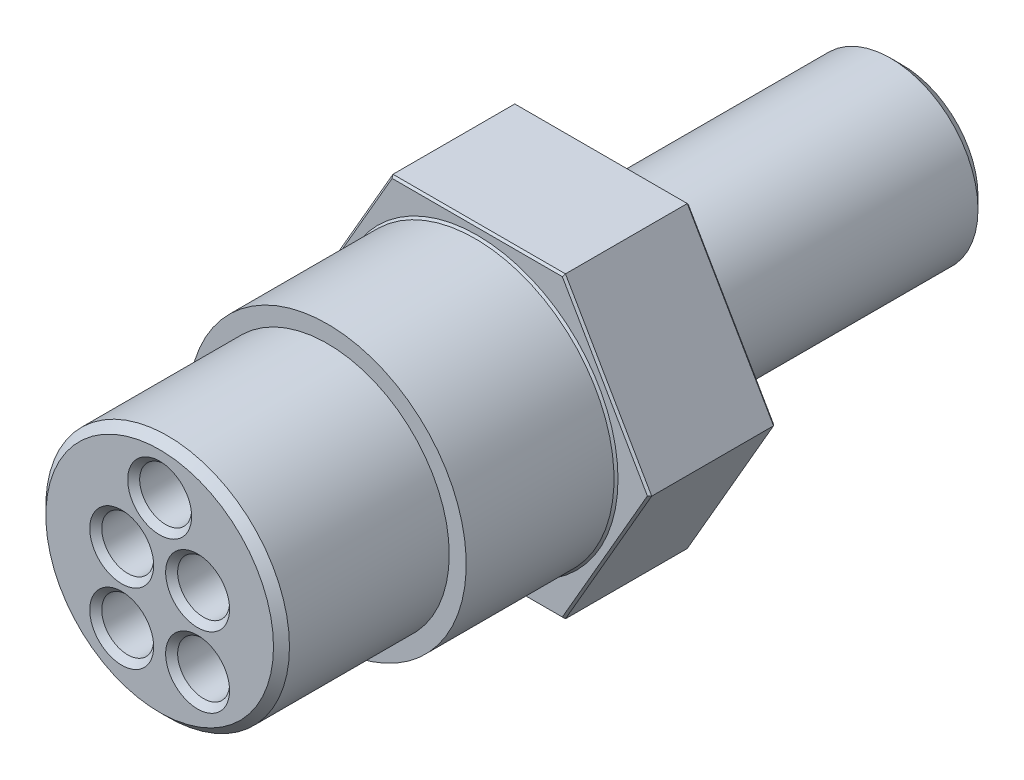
SolidWorks part; units mm, degrees
ref_plane "Front" through (0, 0, 0) normal (0, 0, 1) x (1, 0, 0)
ref_plane "Top" through (0, 0, 0) normal (0, 1, 0) x (1, 0, 0)
ref_plane "Right" through (0, 0, 0) normal (1, 0, 0) x (0, 0, -1)
sketch "Sketch1" plane through (0, 0, 0) normal (0, 0, 1) x (1, 0, 0)
  circle A0 centre (0, 0) radius 5.5562
  dimension "D1" = 11.1125
extrude "post" add sketch "Sketch1" against normal blind 19.05
chamfer "Chamfer1" distance 0.762 angle 45 1 edges at (5.5562, 0, -19.05)
sketch "Sketch2" plane through (0, 0, 0) normal (0, 0, 1) x (1, 0, 0)
  line L1 (-5.4846, 9.4996) -> (-10.9692, 0)
  line L2 (-10.9692, 0) -> (-5.4846, -9.4996)
  line L3 (-5.4846, -9.4996) -> (5.4846, -9.4996)
  line L4 (5.4846, -9.4996) -> (10.9692, 0)
  line L5 (10.9692, 0) -> (5.4846, 9.4996)
  line L6 (5.4846, 9.4996) -> (-5.4846, 9.4996)
  circle A0 centre (0, 0) radius 9.4996 construction
  dimension "D1" = 18.9992
extrude "hex" add sketch "Sketch2" along normal blind 8.001
sketch "Sketch5" plane through (0, 0, 8.001) normal (0, 0, 1) x (1, 0, 0)
  circle A0 centre (0, 0) radius 8.8265
  dimension "D1" = 17.653
extrude "Extrude1" add sketch "Sketch5" along normal blind 9.525
chamfer "Chamfer2" distance 0.127 angle 45 12 edges at (8.2269, 4.7498, 0) (0, 9.4996, 8.001) (-8.2269, 4.7498, 8.001) (-8.2269, -4.7498, 8.001) (0, -9.4996, 8.001) (8.2269, -4.7498, 8.001) (8.2269, 4.7498, 8.001) (-8.8265, 0, 8.001) (0, 9.4996, 0) (-8.2269, -4.7498, 0) (0, -9.4996, 0) (8.2269, -4.7498, 0)
sketch "Sketch3" plane through (0, 0, 17.526) normal (0, 0, 1) x (1, 0, 0)
  circle A0 centre (0, 0) radius 7.747
  dimension "D1" = 15.494
extrude "rubber" add sketch "Sketch3" along normal blind 10.668
chamfer "Chamfer3" distance 0.508 angle 45 1 edges at (7.747, 0, 28.194)
sketch "Sketch4" plane through (0, 0, 28.194) normal (0, 0, 1) x (1, 0, 0)
  line L0 (0, 6.6112) -> (0, -6.1992) construction
  line L3 (0, 0) -> (7.506, 7.506) construction
  line L4 (0, 0) -> (-6.8526, -6.8526) construction
  line L5 (0, 0) -> (7.6052, -7.6052) construction
  line L6 (0, 0) -> (-7.5761, 7.5761) construction
  circle A1 centre (0, 4.572) radius 1.651
  circle A3 centre (2.413, -3.81) radius 1.651
  circle A4 centre (-2.413, 0.6729) radius 1.651
  circle A5 centre (-2.413, -3.81) radius 1.651
  circle A6 centre (2.413, 0.6729) radius 1.651
  dimension "D2" = 45
  dimension "D3" = 3.302
  dimension "D4" = 3.302
  dimension "D5" = 3.302
  dimension "D6" = 3.302
  dimension "D7" = 3.302
  dimension "D8" = 4.572
  dimension "D10" = 4.826
  dimension "D11" = 4.826
  dimension "D12" = 3.81
  dimension "D13" = 2.413
extrude "sockets" cut sketch "Sketch4" against normal blind 6.35
chamfer "Chamfer4" distance 0.381 angle 45 5 edges at (4.064, -3.81, 28.194) (4.064, 0.6729, 28.194) (-0.762, -3.81, 28.194) (-0.762, 0.6729, 28.194) (1.651, 4.572, 28.194)
